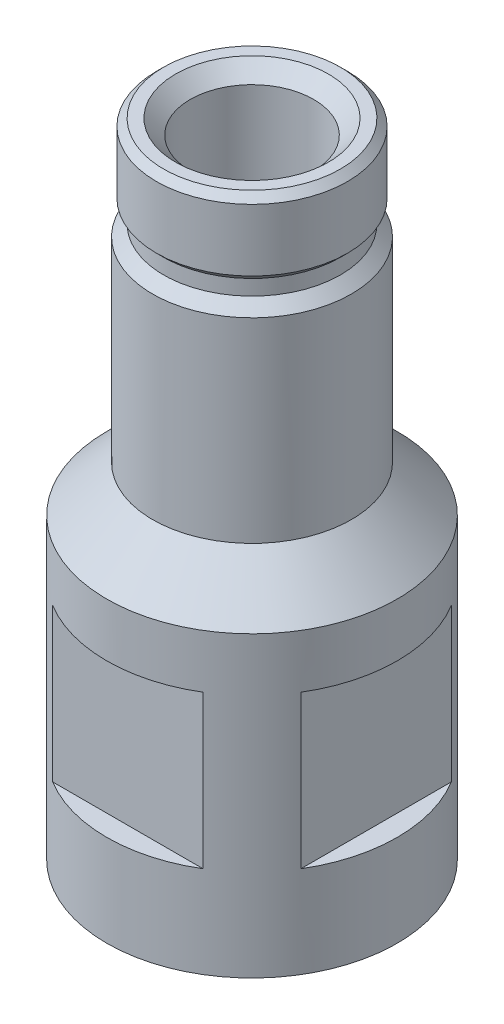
SolidWorks part; units mm, degrees
ref_plane "Front Plane" through (0, 0, 0) normal (0, 0, 1) x (1, 0, 0)
ref_plane "Top Plane" through (0, 0, 0) normal (0, 1, 0) x (1, 0, 0)
ref_plane "Right Plane" through (0, 0, 0) normal (1, 0, 0) x (0, 0, -1)
sketch "Sketch1" plane through (0, 0, 0) normal (0, 1, 0) x (1, 0, 0)
  line L3 (-0.0761, 6.7749) -> (-3.9876, 0) construction
  line L4 (-3.9876, 0) -> (-0.0761, -6.7749) construction
  line L7 (5.8292, 3.4534) -> (-5.8292, 3.4534) construction
  line L8 (5.9053, -3.3216) -> (0.0761, 6.7749) construction
  line L9 (0.0761, -6.7749) -> (5.9053, 3.3216) construction
  line L10 (-5.8292, -3.4534) -> (5.8292, -3.4534) construction
  circle A1 centre (0, 0) radius 12.065
  dimension "D2" = 24.13
extrude "Extrude1" add sketch "Sketch1" along normal blind 53.34
sketch "Sketch6" plane through (0, 0, 0) normal (0, 0, 1) x (1, 0, 0)
  line L0 (0, 0) -> (0, -3.1597) construction
  line L1 (12.065, 53.34) -> (-12.065, 53.34) construction
  line L2 (-5.7531, 25.4) -> (-5.1308, 25.4)
  line L3 (-5.7531, 3.395) -> (-6.1341, 3.175)
  line L4 (-6.1341, 3.175) -> (-6.1341, 0)
  line L5 (-5.7531, 25.4) -> (-5.7531, 3.395)
  line L6 (-5.1308, 25.4) -> (-5.1308, 52.1208)
  line L7 (-6.35, 53.34) -> (-5.1308, 52.1208)
  line L8 (-6.1341, 0) -> (0, 0)
  line L9 (0, 0) -> (0, 53.34)
  line L10 (0, 53.34) -> (-6.35, 53.34)
  line L11 (-12.065, 53.34) -> (-12.065, 0) construction
  line L12 (-12.065, 53.34) -> (-8.255, 53.34)
  line L13 (-12.065, 53.34) -> (-12.065, 24.765)
  line L14 (-12.065, 24.765) -> (-8.255, 28.575)
  line L15 (-8.255, 53.34) -> (-8.255, 28.575)
  dimension "D1" = 12.2682
  dimension "D2" = 11.5062
  dimension "D3" = 60
  dimension "D4" = 3.175
  dimension "D5" = 10.2616
  dimension "D6" = 25.4
  dimension "D7" = 45
  dimension "D8" = 12.7
  dimension "D9" = 16.51
  dimension "D10" = 28.575
  dimension "D11" = 45
revolve "Cut-Revolve2" cut sketch "Sketch6" angle 360 about L0
sketch "Sketch9" plane through (0, 0, 0) normal (0, 0, 1) x (1, 0, 0)
  line L0 (0, 53.34) -> (0, 57.6362) construction
  line L1 (6.35, 53.34) -> (-6.35, 53.34) construction
  line L2 (-8.255, 44.8056) -> (-7.3406, 45.72)
  line L3 (-8.255, 53.34) -> (-7.3406, 53.34)
  line L4 (-8.255, 53.34) -> (-8.255, 44.8056)
  line L5 (8.255, 53.34) -> (-8.255, 53.34) construction
  line L6 (-7.9375, 52.7431) -> (-7.9375, 47.5869)
  line L7 (-8.255, 53.34) -> (-8.255, 28.575) construction
  line L8 (-7.3406, 45.72) -> (-7.3406, 46.99)
  line L9 (-7.3406, 46.99) -> (-7.9375, 47.5869)
  line L10 (-7.9375, 52.7431) -> (-7.3406, 53.34)
  dimension "D1" = 15.875
  dimension "D2" = 14.6812
  dimension "D3" = 6.35
  dimension "D4" = 45
  dimension "D5" = 1.27
revolve "Cut-Revolve4" cut sketch "Sketch9" angle 360 about L0
sketch "Sketch10" plane through (0, 0, 0) normal (0, -1, 0) x (1, 0, 0)
  line L1 (-10.3187, 10.3187) -> (10.3187, 10.3187)
  line L2 (-10.3187, 10.3187) -> (-10.3187, -10.3187)
  line L3 (-10.3187, -10.3187) -> (10.3188, -10.3187)
  line L4 (10.3187, 10.3187) -> (10.3188, -10.3187)
  line L5 (-10.3187, 10.3187) -> (10.3188, -10.3187) construction
  line L6 (-10.3187, -10.3187) -> (10.3187, 10.3187) construction
  point P0 (0, 0)
  dimension "D1" = 20.6375
extrude "Cut-Extrude1" cut sketch "Sketch10" against normal blind 12.7 from offset 7.62 flip side to cut
sketch "Sketch11" plane through (0, 0, 0) normal (0, 0, 1) x (1, 0, 0)
  line L0 (-12.065, 0) -> (12.065, 0) construction
  line L1 (-11.1506, 0) -> (-8.5852, 0)
  line L2 (-11.1506, 0) -> (-11.1506, 1.27)
  line L3 (-11.1506, 1.27) -> (-8.5852, 1.27)
  line L4 (-8.5852, 0) -> (-8.5852, 1.27)
  line L5 (0, 0) -> (0, -3.8495) construction
  dimension "D1" = 2.5654
  dimension "D2" = 17.1704
  dimension "D3" = 1.27
revolve "Cut-Revolve5" cut sketch "Sketch11" angle 360 about L5
